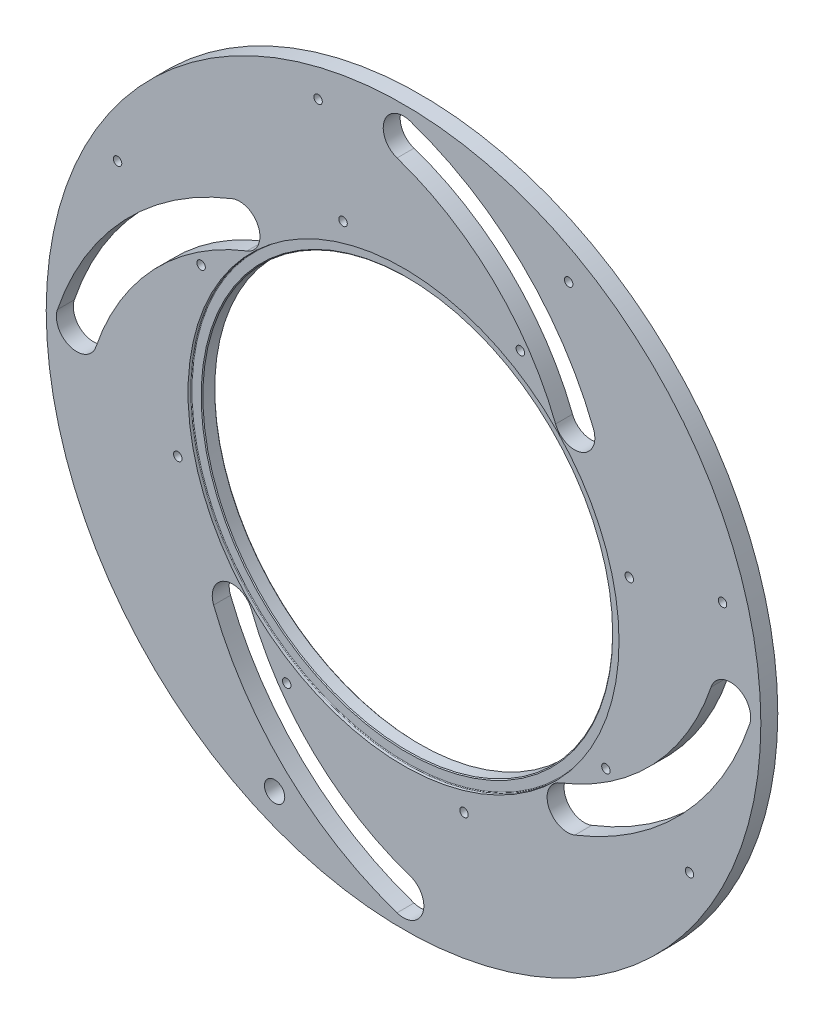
SolidWorks part; units mm, degrees
ref_plane "Plan de face" through (0, 0, 0) normal (0, 0, 1) x (1, 0, 0)
ref_plane "Plan de dessus" through (0, 0, 0) normal (0, 1, 0) x (1, 0, 0)
ref_plane "Plan de droite" through (0, 0, 0) normal (1, 0, 0) x (0, 0, -1)
sketch "Esquisse1" plane through (0, 0, 0) normal (0, 0, 1) x (1, 0, 0)
  circle A0 centre (0, 0) radius 121
  circle A1 centre (0, 0) radius 211
  dimension "D1" = 242
  dimension "D2" = 422
extrude "Extrusion1" add sketch "Esquisse1" along normal blind 10
sketch "Esquisse2" plane through (0, 0, 10) normal (0, 0, 1) x (1, 0, 0)
  line L0 (0, 0) -> (0, 193) construction
  line L1 (0, 193) -> (-52.68, 36.6356) construction
  line L2 (-52.68, 36.6356) -> (100.9641, 96.7895) construction
  line L3 (0, 0) -> (100.9641, 96.7895) construction
  arc A0 (3.8313, 204.372) -> (-3.8313, 181.628) centre (0, 193) ccw
  arc A1 (89.79, 92.4147) -> (112.1382, 101.1643) centre (100.9641, 96.7895) ccw
  arc A2 (112.1382, 101.1643) -> (3.8313, 204.372) centre (-52.68, 36.6356) ccw
  arc A3 (89.79, 92.4147) -> (-3.8313, 181.628) centre (-52.68, 36.6356) ccw
  circle A5 centre (-52.68, 36.6356) radius 165 construction
  dimension "D1" = 24
  dimension "D3" = 50
  dimension "D5" = 330
  dimension "D2" = 193
  dimension "D4" = 52.68
  dimension "D6" = 46.209
extrude "Extrusion2" cut sketch "Esquisse2" against normal through all
pattern_circular "Répétition circulaire1" count 4 over 360 about axis through (0, 0, 0) along (0, 0, 1) of "Extrusion2"
chamfer "Chanfrein1" distance 0.5 angle 45 1 edges at (121, 0, 10)
sketch "Esquisse4" plane through (0, 0, 10) normal (0, 0, 1) x (1, 0, 0)
  line L0 (0, 0) -> (0, -193) construction
  line L1 (0, 0) -> (-100.9641, -96.7895) construction
  line L2 (0, 0) -> (-76.128, -178.4392) construction
  circle A0 centre (-76.128, -178.4392) radius 6
  dimension "D1" = 12
  dimension "D3" = 194
extrude "Extrusion4" cut sketch "Esquisse4" against normal through all
sketch "Esquisse6" plane through (0, 0, 10) normal (0, 0, 1) x (1, 0, 0)
  circle A0 centre (0, 0) radius 127.25
  dimension "D1" = 254.5
extrude "Extrusion6" cut sketch "Esquisse6" against normal blind 2
chamfer "Chanfrein3" distance 0.5 angle 45 2 edges at (121, 0, 8) (121, 0, 0)
hole_wizard "Diamètre du perçage Ø5.0 (5)1" positions "Esquisse8" profile "Esquisse9" hole size "Ø5.0" standard "ISO"
sketch "Esquisse8" plane through (0, 0, 0) normal (0, 0, -1) x (-1, 0, 0)
  line L0 (0, 0) -> (-123.2072, 213.4011) construction
  line L1 (0, 0) -> (0, 225.9037) construction
  point P0 (-69, 119.5115)
  dimension "D1" = 30
  dimension "D2" = 138
sketch "Esquisse9" plane through (69, 119.5115, 0) normal (1, 0, 0) x (0, 1, 0)
  line L0 (0, 0) -> (0, 10)
  line L1 (0, 10) -> (2.5, 10)
  line L2 (2.5, 10) -> (2.5, 0)
  line L5 (2.5, 0) -> (0, 0)
  line L11 (0, -6.35) -> (0, 107.95) construction
  dimension "Diamètre du perçage jusqu'au prochain" = 5
  dimension "Profondeur du perçage jusqu'au prochain" = 10
thread "Filetage1" pitch 1 start angle 0, offset 5, length 20, pitch 1, diameter 5
ref_plane "Plan1" through (66.5, 119.5115, 15) normal (0, -1, 0) x (-1, 0, 0)
sketch "Profil de filetage1" plane through (66.5, 119.5115, 15) normal (0, -1, 0) x (-1, 0, 0)
  line L0 (0, 0) -> (0, 1) construction
  line L1 (0, 0) -> (0.5413, 0.3125)
  line L2 (0.5413, 0.3125) -> (0.5413, 0.4375)
  line L3 (0.5413, 0.4375) -> (0, 0.75)
  line L4 (0.5413, 0.375) -> (0, 0.375) construction
  line L11 (0, 0) -> (0, 0.75)
  point P2 (0, 0)
  dimension "Pitch" = 1
  dimension "Profile_Angle" = 60
  dimension "Profile_Land" = 0.125
  dimension "Profile_Height" = 0.5413
pattern_circular "Répétition circulaire2" count 8 over 360 about axis through (0, 0, 0) along (0, 0, 1) of "Diamètre du perçage Ø5.0 (5)1", "Filetage1"
hole_wizard "Diamètre du perçage Ø5.0 (5)2" positions "Esquisse11" profile "Esquisse10" hole size "Ø5.0" standard "ISO"
sketch "Esquisse11" plane through (0, 0, 0) normal (0, 0, -1) x (-1, 0, 0)
  line L0 (0, 0) -> (-69, 119.5115) construction
  line L1 (0, 0) -> (0, 237.8131) construction
  point P0 (-97.5, 168.875)
  dimension "D1" = 195
sketch "Esquisse10" plane through (97.5, 168.875, 0) normal (1, 0, 0) x (0, 1, 0)
  line L0 (0, 0) -> (0, 10)
  line L1 (0, 10) -> (2.5, 10)
  line L2 (2.5, 10) -> (2.5, 0)
  line L5 (2.5, 0) -> (0, 0)
  line L11 (0, -6.35) -> (0, 107.95) construction
  dimension "Diamètre du perçage jusqu'au prochain" = 5
  dimension "Profondeur du perçage jusqu'au prochain" = 10
thread "Filetage2" pitch 1 start angle 0, offset 5, length 20, pitch 1, diameter 5
ref_plane "Plan2" through (95, 168.875, 15) normal (0, -1, 0) x (-1, 0, 0)
sketch "Profil de filetage2" plane through (95, 168.875, 15) normal (0, -1, 0) x (-1, 0, 0)
  line L0 (0, 0) -> (0, 1) construction
  line L1 (0, 0) -> (0.5413, 0.3125)
  line L2 (0.5413, 0.3125) -> (0.5413, 0.4375)
  line L3 (0.5413, 0.4375) -> (0, 0.75)
  line L4 (0.5413, 0.375) -> (0, 0.375) construction
  line L11 (0, 0) -> (0, 0.75)
  point P2 (0, 0)
  dimension "Pitch" = 1
  dimension "Profile_Angle" = 60
  dimension "Profile_Land" = 0.125
  dimension "Profile_Height" = 0.5413
pattern_circular "Répétition circulaire3" count 8 over 360 about axis through (0, 0, 0) along (0, 0, 1) of "Diamètre du perçage Ø5.0 (5)2", "Filetage2"
fillet "Congé1" radius 0.4 1 edges at (127.25, 0, 8)
